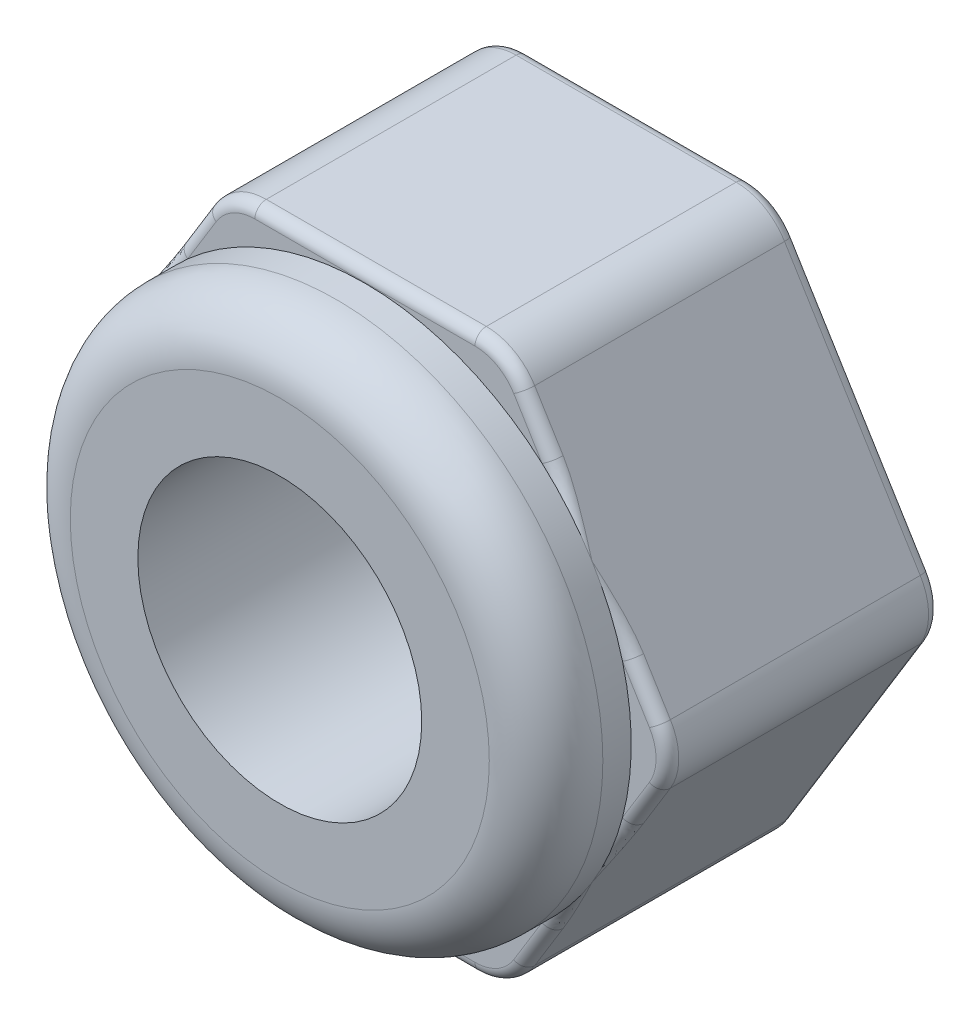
SolidWorks part; units mm, degrees
ref_plane "Plan1" through (0, 0, 0) normal (0, 0, 1) x (1, 0, 0)
ref_plane "Plan2" through (0, 0, 0) normal (0, 1, 0) x (1, 0, 0)
ref_plane "Plan3" through (0, 0, 0) normal (1, 0, 0) x (0, 0, -1)
sketch "Esquisse1" plane through (0, 0, 0) normal (0, 0, 1) x (1, 0, 0)
  line L0 (-5.5, 0) -> (-2.498, 4.9)
  line L1 (-2.498, 4.9) -> (2.498, 4.9)
  line L2 (2.498, 4.9) -> (5.5, 0)
  line L3 (5.5, 0) -> (2.498, -4.9)
  line L4 (2.498, -4.9) -> (-2.498, -4.9)
  line L5 (-2.498, -4.9) -> (-5.5, 0)
  line L6 (-9.4286, 0) -> (9.4286, 0) construction
  line L7 (0, 6.8711) -> (0, -6.8711) construction
  circle A0 centre (0, 0) radius 5.5 construction
  circle A1 centre (0, 0) radius 2.5
  dimension "D3" = 5
  dimension "D1" = 11
  dimension "D2" = 9.8
extrude "Base-Extrusion" add sketch "Esquisse1" along normal blind 4.8
sketch "Esquisse2" plane through (0, 0, 4.8) normal (0, 0, 1) x (1, 0, 0)
  line L0 (-5.5, 0) -> (-2.498, 4.9) construction
  circle A0 centre (0, 0) radius 4.6898
  circle A1 centre (0, 0) radius 2.5
  circle A2 centre (0, 0) radius 2.5 construction
extrude "Boss.-Extru.1" add sketch "Esquisse2" along normal blind 1.5
fillet "Congé1" radius 1
fillet "Congé2" radius 0.2
